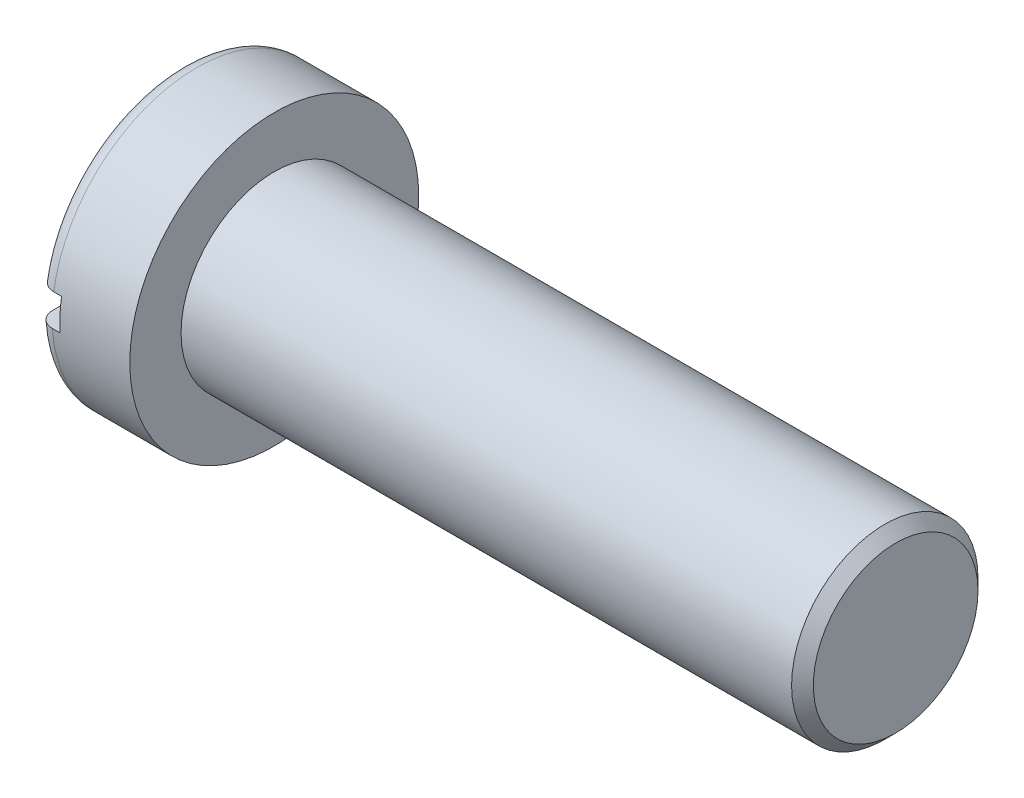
SolidWorks part; units mm, degrees
ref_plane "Plane1" through (0, 0, 0) normal (0, 0, 1) x (1, 0, 0)
ref_plane "Plane2" through (0, 0, 0) normal (0, 1, 0) x (1, 0, 0)
ref_plane "Plane3" through (0, 0, 0) normal (1, 0, 0) x (0, 0, -1)
sketch "Esquisse1" plane through (0, 0, 0) normal (0, 0, 1) x (1, 0, 0)
  line L0 (0, 0) -> (91.2762, 0) construction
  line L1 (0, 0) -> (0, 4.65)
  line L2 (0, 4.65) -> (3, 4.65)
  line L3 (3, 4.65) -> (3, 3)
  line L4 (3, 3) -> (23, 3)
  line L5 (23, 3) -> (23, 0)
  line L6 (23, 0) -> (0, 0)
  dimension "D1" = 3
  dimension "D2" = 20
  dimension "D3" = 3
  dimension "D4" = 9.3
revolve "Base-Révolution" add sketch "Esquisse1" angle 360 about L0
sketch "Esquisse3" plane through (0, 0, 0) normal (0, 0, 1) x (1, 0, 0)
  line L0 (0, -0.3) -> (0, 0.7)
  line L1 (0, 4.65) -> (0, -4.65) construction
  line L2 (0, 0.7) -> (0.75, 0.7)
  line L3 (0.75, 0.7) -> (0.75, -0.3)
  line L4 (0.75, -0.3) -> (0, -0.3)
  dimension "D1" = 0.7
  dimension "D2" = 1
  dimension "D3" = 0.75
extrude "Couper-Extrusion1" cut sketch "Esquisse3" against normal mid plane 10
fillet "Congé1" radius 0.5 2 edges at (0, -4.65, 0) (0, 4.65, 0)
chamfer "Chanfrein2" distance 0.35 angle 45 1 edges at (23, 0, 3)
